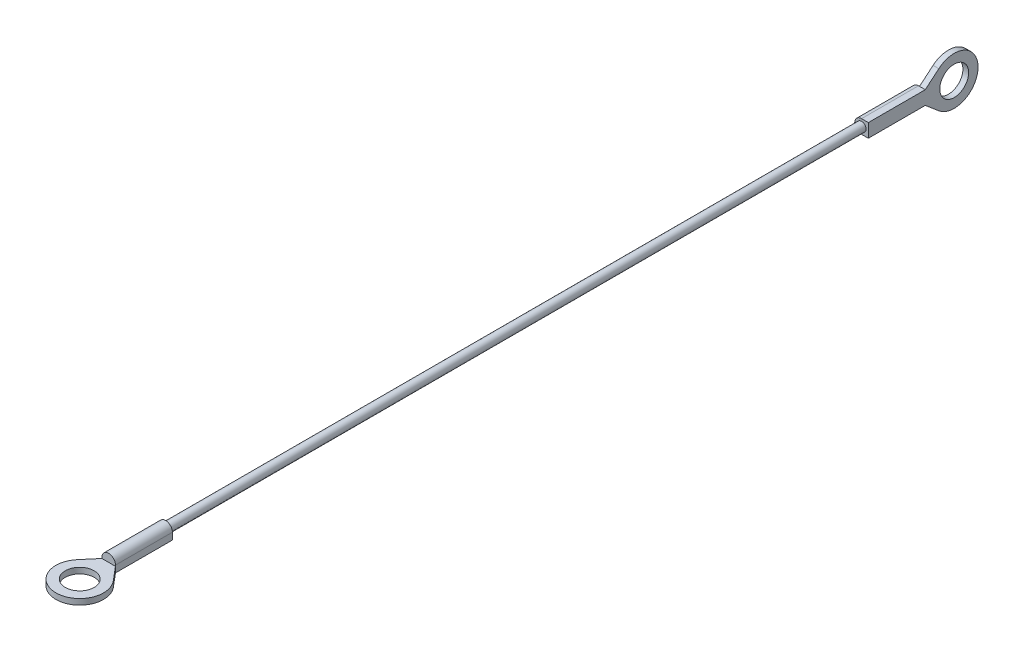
SolidWorks part; units mm, degrees
ref_plane "Front Plane" through (0, 0, 0) normal (0, 0, 1) x (1, 0, 0)
ref_plane "Top Plane" through (0, 0, 0) normal (0, 1, 0) x (1, 0, 0)
ref_plane "Right Plane" through (0, 0, 0) normal (1, 0, 0) x (0, 0, -1)
sketch "Sketch1" plane through (0, 0, 0) normal (0, 0, 1) x (1, 0, 0)
  circle A0 centre (0, 0) radius 0.795
extrude "Boss-Extrude1" add sketch "Sketch1" along normal mid plane 122.24
sketch "Sketch2" plane through (0, 0, 61.12) normal (0, 0, 1) x (1, 0, 0)
  line L0 (-1.195, 0) -> (-1.195, -1.195)
  line L1 (-1.195, -1.195) -> (0, -1.195)
  line L2 (0, -1.195) -> (1.195, -1.195)
  line L3 (1.195, -1.195) -> (1.195, 0)
  arc A0 (1.195, 0) -> (-1.195, 0) centre (0, 0) ccw
  dimension "D1" = 2.39
extrude "Boss-Extrude2" add sketch "Sketch2" along normal blind 10
sketch "Sketch3" plane through (0, -1.195, 0) normal (0, -1, 0) x (1, 0, 0)
  line L0 (1.195, 71.12) -> (3.2017, 73.4972)
  line L1 (-3.2017, 73.4972) -> (-1.195, 71.12)
  line L2 (-1.195, 71.12) -> (1.195, 71.12)
  arc A0 (3.2017, 73.4972) -> (-3.2017, 73.4972) centre (0, 76.2) ccw
  circle A1 centre (0, 76.2) radius 2.54
  point P8 (4.19, 76.2)
  point P9 (-4.19, 76.2)
  dimension "D1" = 5.08
  dimension "D2" = 8.38
  dimension "D3" = 76.2
extrude "Boss-Extrude3" add sketch "Sketch3" against normal blind 1.01
sketch "Sketch4" plane through (0, 0, -61.12) normal (0, 0, -1) x (-1, 0, 0)
  line L0 (0, 1.195) -> (-1.195, 1.195)
  line L1 (-1.195, 1.195) -> (-1.195, 0)
  line L2 (-1.195, 0) -> (-1.195, -1.195)
  line L3 (-1.195, -1.195) -> (0, -1.195)
  arc A0 (0, -1.195) -> (0, 1.195) centre (0, 0) ccw
  dimension "D1" = 2.39
extrude "Boss-Extrude4" add sketch "Sketch4" along normal blind 10
sketch "Sketch5" plane through (1.195, 0, 0) normal (1, 0, 0) x (0, 0, -1)
  line L0 (71.12, -1.195) -> (71.12, 1.195)
  line L1 (71.12, 1.195) -> (73.4972, 3.2017)
  line L2 (73.4972, -3.2017) -> (71.12, -1.195)
  arc A0 (73.4972, 3.2017) -> (73.4972, -3.2017) centre (76.2, 0) cw
  circle A1 centre (76.2, 0) radius 2.54
  point P8 (76.2, 4.19)
  point P9 (76.2, -4.19)
  dimension "D1" = 5.08
  dimension "D2" = 8.38
  dimension "D3" = 76.2
extrude "Boss-Extrude5" add sketch "Sketch5" against normal blind 1.01
